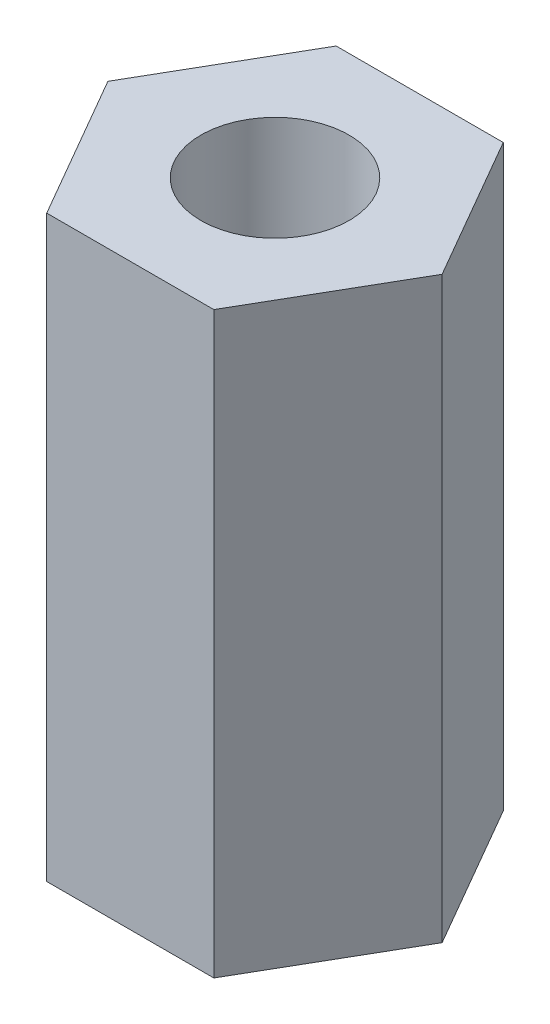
SolidWorks part; units mm, degrees
ref_plane "Front Plane" through (0, 0, 0) normal (0, 0, 1) x (1, 0, 0)
ref_plane "Top Plane" through (0, 0, 0) normal (0, 1, 0) x (1, 0, 0)
ref_plane "Right Plane" through (0, 0, 0) normal (1, 0, 0) x (0, 0, -1)
sketch "Sketch1" plane through (0, 0, 0) normal (0, 1, 0) x (1, 0, 0)
  line L1 (1.8331, 3.175) -> (-1.8331, 3.175)
  line L2 (-1.8331, 3.175) -> (-3.6662, 0)
  line L3 (-3.6662, 0) -> (-1.8331, -3.175)
  line L4 (-1.8331, -3.175) -> (1.8331, -3.175)
  line L5 (1.8331, -3.175) -> (3.6662, 0)
  line L6 (3.6662, 0) -> (1.8331, 3.175)
  circle A0 centre (0, 0) radius 3.175 construction
  circle A1 centre (0, 0) radius 1.6256
  dimension "D2" = 3.2512
  dimension "D1" = 6.35
extrude "Boss-Extrude1" add sketch "Sketch1" along normal blind 12.7
